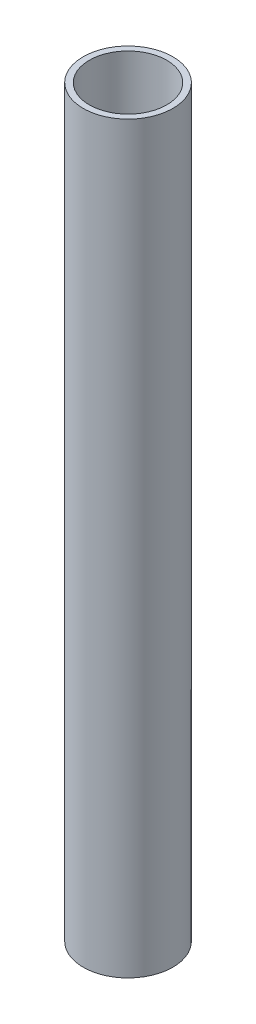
SolidWorks part; units mm, degrees
ref_plane "Front Plane" through (0, 0, 0) normal (0, 0, 1) x (1, 0, 0)
ref_plane "Top Plane" through (0, 0, 0) normal (0, 1, 0) x (1, 0, 0)
ref_plane "Right Plane" through (0, 0, 0) normal (1, 0, 0) x (0, 0, -1)
sketch "Sketch1" plane through (0, 0, 0) normal (0, 1, 0) x (1, 0, 0)
  circle A0 centre (0, 0) radius 6.35
  circle A1 centre (0, 0) radius 7.35
  dimension "D1" = 12.7
  dimension "D2" = 1
extrude "Boss-Extrude1" add sketch "Sketch1" along normal blind 122
